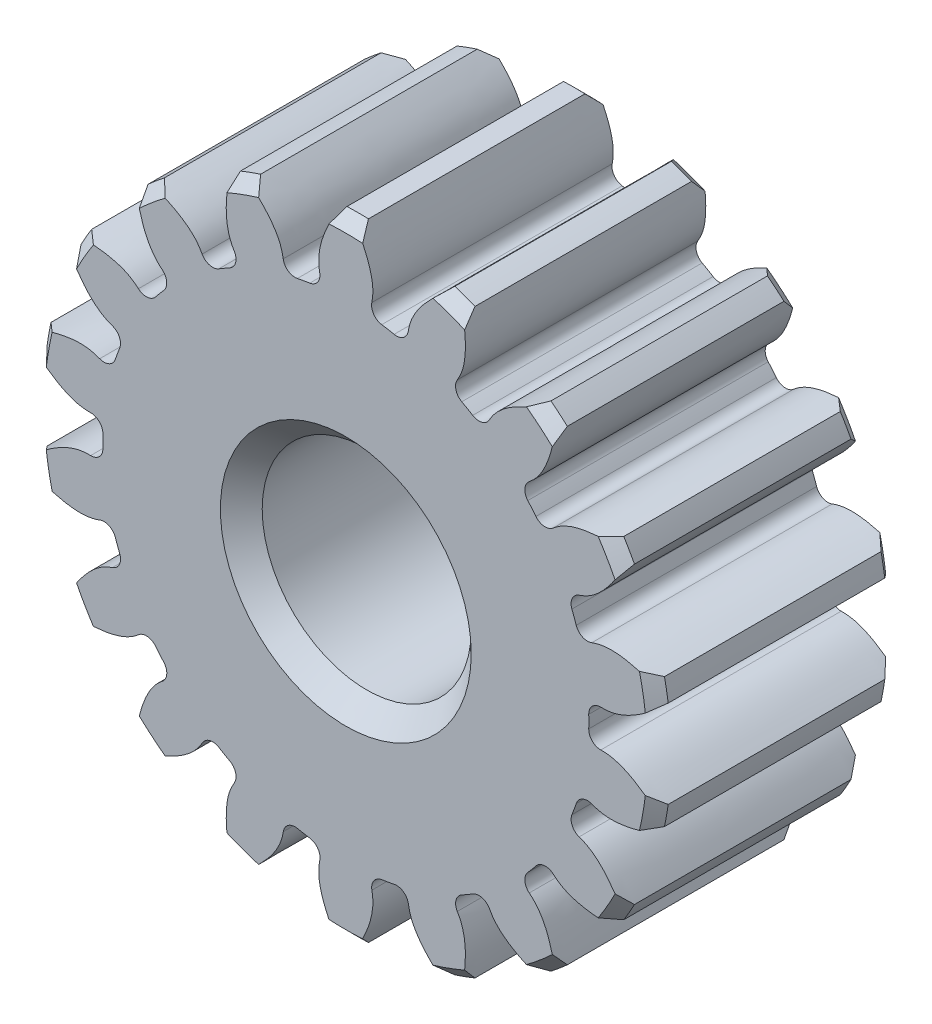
SolidWorks part; units mm, degrees
ref_plane "Plan1" through (0, 0, 0) normal (0, 0, 1) x (1, 0, 0)
ref_plane "Plan2" through (0, 0, 0) normal (0, 1, 0) x (1, 0, 0)
ref_plane "Plan3" through (0, 0, 0) normal (1, 0, 0) x (0, 0, -1)
sketch "Dent" plane through (0, 0, 0) normal (0, 0, 1) x (1, 0, 0)
  line L1 (-0.5128, 10.2479) -> (0, 8.8389)
  line L3 (0, 15) -> (0, -15) construction
  line L4 (0, 0) -> (0.5128, 14.9912) construction
  line L5 (1.1781, 13.4485) -> (-1.1781, 13.4485) construction
  line L6 (1.2953, 12.6196) -> (-1.2953, 12.6196) construction
  line L7 (-0.75, 0) -> (0.75, 0) construction
  line L9 (0.5128, 10.2479) -> (0, 8.8389)
  line L11 (0, 0) -> (1.1781, 13.4485) construction
  line L12 (0, 0) -> (1.2953, 12.6196) construction
  circle A0 centre (0, 0) radius 13.5 construction
  circle A1 centre (0, 0) radius 15 construction
  arc A2 (0.5128, 14.9912) -> (-0.5128, 14.9912) centre (0, 0) ccw
  circle A3 centre (0, 0) radius 12.6859 construction
  point P2 (-1.1781, 13.4485)
  point P3 (-1.2953, 12.6196)
  point P19 (1.1781, 13.4485)
  point P20 (1.2953, 12.6196)
sketch "Esquisse2" plane through (0, 0, 0) normal (0, 0, 1) x (1, 0, 0)
  circle A0 centre (0, 0) radius 11.625
extrude "Base-Extrusion" add sketch "Esquisse2" against normal blind 11.5
extrude "Boss.-Extru.1" add sketch "Dent" against normal blind 11.5
fillet "Congé1" radius 0.57 4 edges at (1.0666, 11.576, -5.75) (-1.0797, 11.5747, -5.75)
chamfer "Chanfrein1" distance 0.57 angle 45 4 edges at (0, 15, -11.5) (0, 15, 0)
pattern_circular "Répétition circulaire1" count 18 over 360 about axis through (0, 0, -11.5) along (0, 0, 1) of "Congé1", "Boss.-Extru.1", "Chanfrein1"
sketch "Esquisse3" plane through (0, 0, 0) normal (0, 0, 1) x (1, 0, 0)
  circle A0 centre (0, 0) radius 5
  dimension "D1" = 10
extrude "Enlèv. mat.-Extru.1" cut sketch "Esquisse3" against normal through all
chamfer "Chanfrein2" distance 1 angle 45 2 edges at (5, 0, -11.5) (5, 0, 0)
sketch "Esquisse4" plane through (0, 0, 0) normal (0, 0, 1) x (1, 0, 0)
  line L0 (0, 0) -> (9.0524, 0)
  line L1 (0, 0) -> (-5.0343, 8.7197)
  line L2 (0, 0) -> (-4.9846, -8.6336)
  dimension "D1" = 120
  dimension "D2" = 120
equation "\"Dp@Dent\" = \"Module@Dent\"*\"Nbr de dents@Répétition circulaire1\" "
equation "\"Dt@Dent\" = \"Module@Dent\"*(\"Nbr de dents@Répétition circulaire1\"+2)"
equation "\"Dpied@Esquisse2\" = \"Dp@Dent\"-(2.5*\"Module@Dent\")"
equation "\"Db@Dent\" = \"Dp@Dent\"*cos(\"Angle de pression@Dent\"*pi/180)"
equation "\"Ep au primitif@Dent\" =  (pi*\"Dp@Dent\"/2)/\"Nbr de dents@Répétition circulaire1\""
equation "\"D3@Dent\"=atn((Sin((sqr(((\"Dt@Dent\"/\"Db@Dent\")^2)-1))) -((sqr(((\"Dt@Dent\"/\"Db@Dent\")^2)-1)) * Cos((sqr(((\"Dt@Dent\"/\"Db@Dent\")^2)-1)))))/(Cos((sqr(((\"Dt@Dent\"/\"Db@Dent\")^2)-1))) +((sqr(((\"Dt@Dent\"/\"Db@"
equation "\"D4@Dent\"=atn((Sin((sqr(((\"Dp@Dent\"/\"Db@Dent\")^2)-1))) -((sqr(((\"Dp@Dent\"/\"Db@Dent\")^2)-1)) * Cos((sqr(((\"Dp@Dent\"/\"Db@Dent\")^2)-1)))))/(Cos((sqr(((\"Dp@Dent\"/\"Db@Dent\")^2)-1))) +((sqr(((\"Dp@Dent\"/\"Db@"
equation "\"D1@Congé1\" = \"Module@Dent\"*0.38"
equation "\"D1@Base-Extrusion\" = \"Epaisseur@Boss.-Extru.1\""
